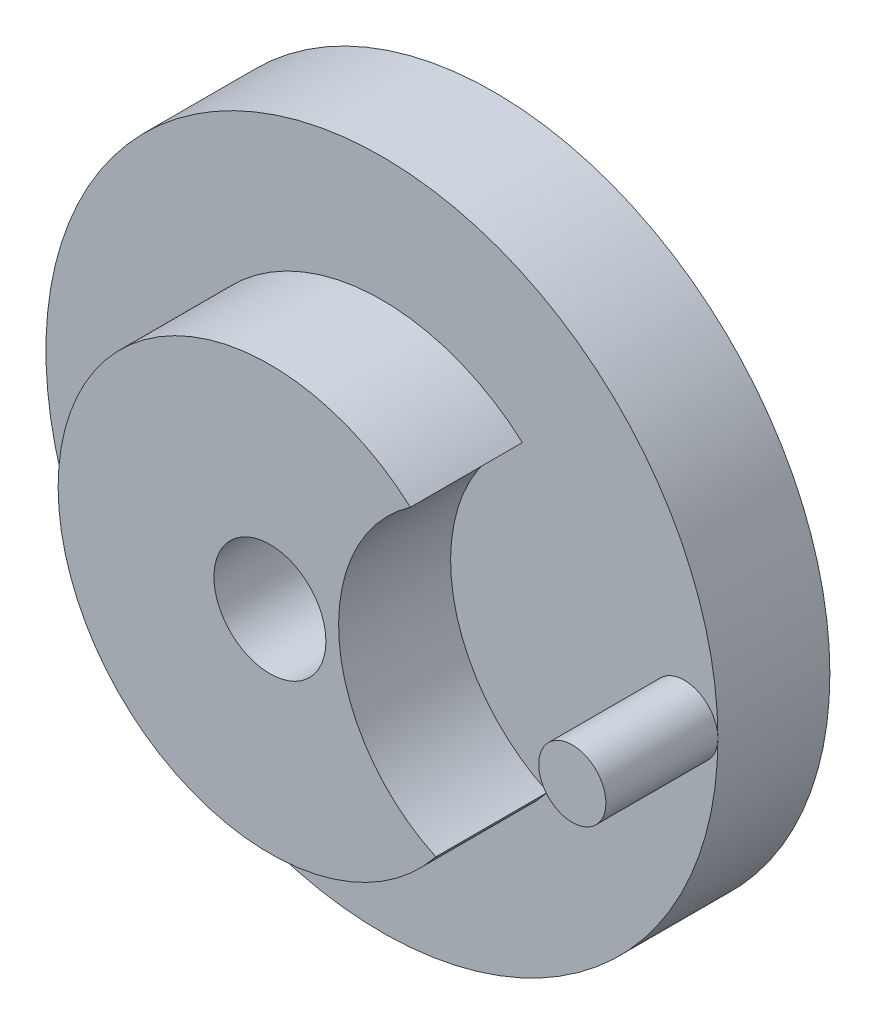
SolidWorks part; units mm, degrees
ref_plane "Plan de face" through (0, 0, 0) normal (0, 0, 1) x (1, 0, 0)
ref_plane "Plan de dessus" through (0, 0, 0) normal (0, 1, 0) x (1, 0, 0)
ref_plane "Plan de droite" through (0, 0, 0) normal (1, 0, 0) x (0, 0, -1)
sketch "Esquisse1" plane through (0, 0, 0) normal (0, 0, 1) x (1, 0, 0)
  circle A0 centre (0, 0) radius 30
  circle A1 centre (0, 0) radius 5
  dimension "D1" = 10
  dimension "D2" = 60
extrude "Extrusion1" add sketch "Esquisse1" along normal blind 10
sketch "Esquisse3" [suppressed] plane through (0, 0, 10) normal (0, 0, 1) x (1, 0, 0)
  line L0 (30, 0) -> (35, 0)
  line L1 (0, 30) -> (0, 35)
  arc A0 (0, 30) -> (30, 0) centre (0, 0) ccw
  circle A1 centre (0, 0) radius 35 construction
  arc A2 (0, 35) -> (35, 0) centre (0, 0) ccw
  dimension "D1" = 30
sketch "Esquisse4" plane through (0, 0, 10) normal (0, 0, 1) x (1, 0, 0)
  circle A0 centre (27, 0) radius 3
  dimension "D1" = 6
  dimension "D2" = 27
extrude "Extrusion2" add sketch "Esquisse4" along normal blind 10
sketch "Esquisse5" plane through (0, 0, 10) normal (0, 0, 1) x (1, 0, 0)
  circle A0 centre (0, 0) radius 18.91
  dimension "D1" = 37.82
extrude "Extrusion3" add sketch "Esquisse5" along normal blind 10
sketch "Esquisse6" plane through (0, 0, 20) normal (0, 0, 1) x (1, 0, 0)
  circle A0 centre (0, 0) radius 5 construction
  circle A1 centre (0, 0) radius 5
extrude "Enlèv. mat.-Extru.1" cut sketch "Esquisse6" against normal blind 10
sketch "Esquisse7" plane through (0, 0, 20) normal (0, 0, 1) x (1, 0, 0)
  line L0 (0, 0) -> (29.0788, -24.4) construction
  line L1 (0, 0) -> (23.7313, 28.2819) construction
  line L2 (0, 0) -> (72.455, 0) construction
  arc A0 (12.5464, 14.1484) -> (14.8126, -11.7548) centre (21.1325, 1.8489) ccw
  circle A1 centre (0, 0) radius 18.91 construction
  arc A2 (14.8126, -11.7548) -> (12.5464, 14.1484) centre (0, 0) ccw
  dimension "D2" = 30
  dimension "D1" = 40
extrude "Enlèv. mat.-Extru.2" cut sketch "Esquisse7" against normal up to surface (10 mm away)
